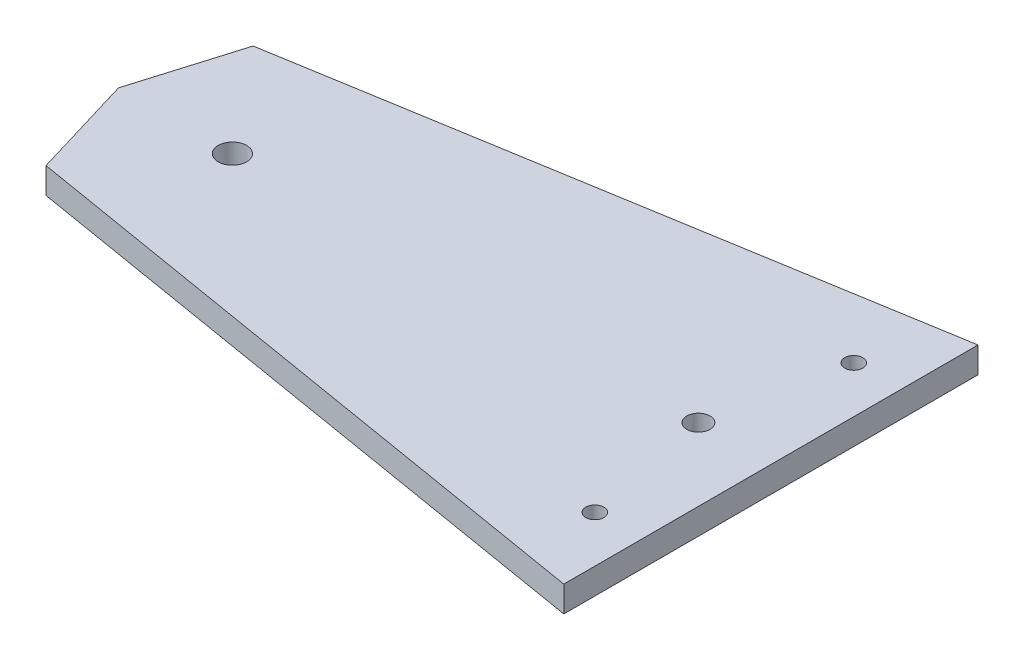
SolidWorks part; units mm, degrees
ref_plane "Front Plane" through (0, 0, 0) normal (0, 0, 1) x (1, 0, 0)
ref_plane "Top Plane" through (0, 0, 0) normal (0, 1, 0) x (1, 0, 0)
ref_plane "Right Plane" through (0, 0, 0) normal (1, 0, 0) x (0, 0, -1)
sketch "Sketch1" plane through (0, 0, 0) normal (0, 1, 0) x (1, 0, 0)
  line L0 (0, 0) -> (126, 0) construction
  line L1 (126, -40) -> (126, 40)
  line L2 (126, 40) -> (6, 20)
  line L3 (6, 20) -> (0, 0)
  line L4 (126, -40) -> (6, -20)
  line L5 (6, -20) -> (0, 0)
  circle A0 centre (22, 0) radius 2.75
  circle A1 centre (112, 0) radius 2.25
  circle A2 centre (117, 25) radius 1.75
  circle A3 centre (117, -25) radius 1.75
  dimension "D1" = 3.5
  dimension "D2" = 4.5
  dimension "D3" = 5.5
  dimension "D7" = 14
  dimension "D8" = 16
  dimension "D9" = 9
  dimension "D10" = 25
  dimension "D11" = 95
  dimension "D4" = 20
  dimension "D5" = 6
  dimension "D6" = 40
extrude "Boss-Extrude1" add sketch "Sketch1" against normal blind 5
